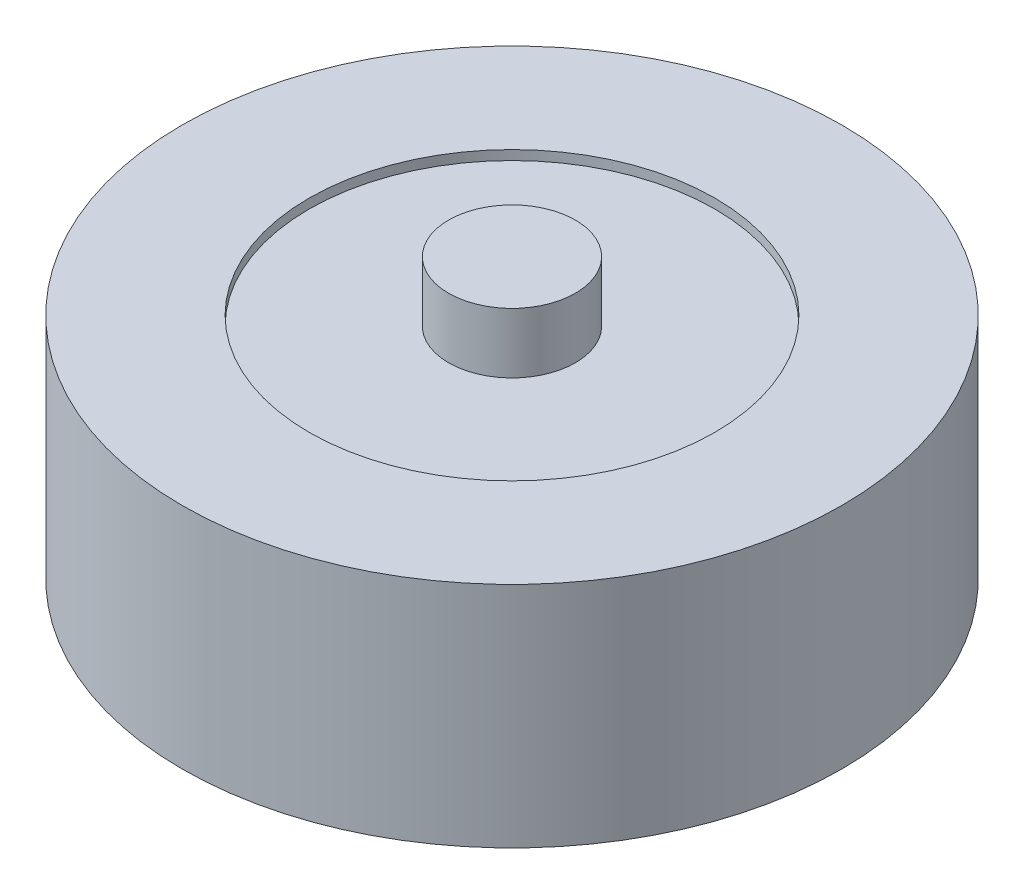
SolidWorks part; units mm, degrees
ref_plane "Front Plane" through (0, 0, 0) normal (0, 0, 1) x (1, 0, 0)
ref_plane "Top Plane" through (0, 0, 0) normal (0, 1, 0) x (1, 0, 0)
ref_plane "Right Plane" through (0, 0, 0) normal (1, 0, 0) x (0, 0, -1)
sketch "Sketch1" plane through (0, 0, 0) normal (0, 1, 0) x (1, 0, 0)
  circle A0 centre (0, 0) radius 26
  dimension "D1" = 52
extrude "Extrude1" add sketch "Sketch1" along normal blind 18
sketch "Sketch2" plane through (0, 18, 0) normal (0, 1, 0) x (1, 0, 0)
  circle A0 centre (0, 0) radius 16
  dimension "D1" = 32
extrude "Extrude2" cut sketch "Sketch2" against normal blind 0.75
sketch "Sketch3" plane through (0, 17.25, 0) normal (0, 1, 0) x (1, 0, 0)
  circle A0 centre (0, 0) radius 5
  dimension "D1" = 10
extrude "Extrude3" add sketch "Sketch3" along normal blind 4.75
hole_wizard "M5x0.8 Tapped Hole1" positions "Sketch5" profile "Sketch4" tap size "M5x0.8" standard "Ansi Metric"
sketch "Sketch5" plane through (0, 0, 0) normal (0, -1, 0) x (1, 0, 0)
  line L0 (0, 0) -> (0, -15.372) construction
  line L2 (0, 0) -> (-15.5563, -15.5563) construction
  point P0 (-15.5563, -15.5563)
  dimension "D1" = 22
  dimension "D2" = 45
sketch "Sketch4" plane through (-15.5563, 0, -15.5563) normal (1, 0, 0) x (0, 0, -1)
  line L0 (0, 0) -> (0, 11.6618)
  line L1 (0, 11.6618) -> (2.1, 10.4)
  line L2 (2.1, 10.4) -> (2.1, 0)
  line L5 (2.1, 0) -> (0, 0)
  line L10 (0, 11.6618) -> (-2.1, 10.4) construction
  line L11 (0, -6.35) -> (0, 107.95) construction
  dimension "Tap Drill Dia." = 4.2
  dimension "Tap Drill Depth" = 10.4
  dimension "Drill Angle" = 118
pattern_circular "CirPattern1" count 4 over 360 about axis through (0, 0, 0) along (0, 1, 0) of "M5x0.8 Tapped Hole1"
chamfer "Chamfer1" [suppressed] distance 0.75 angle 45
